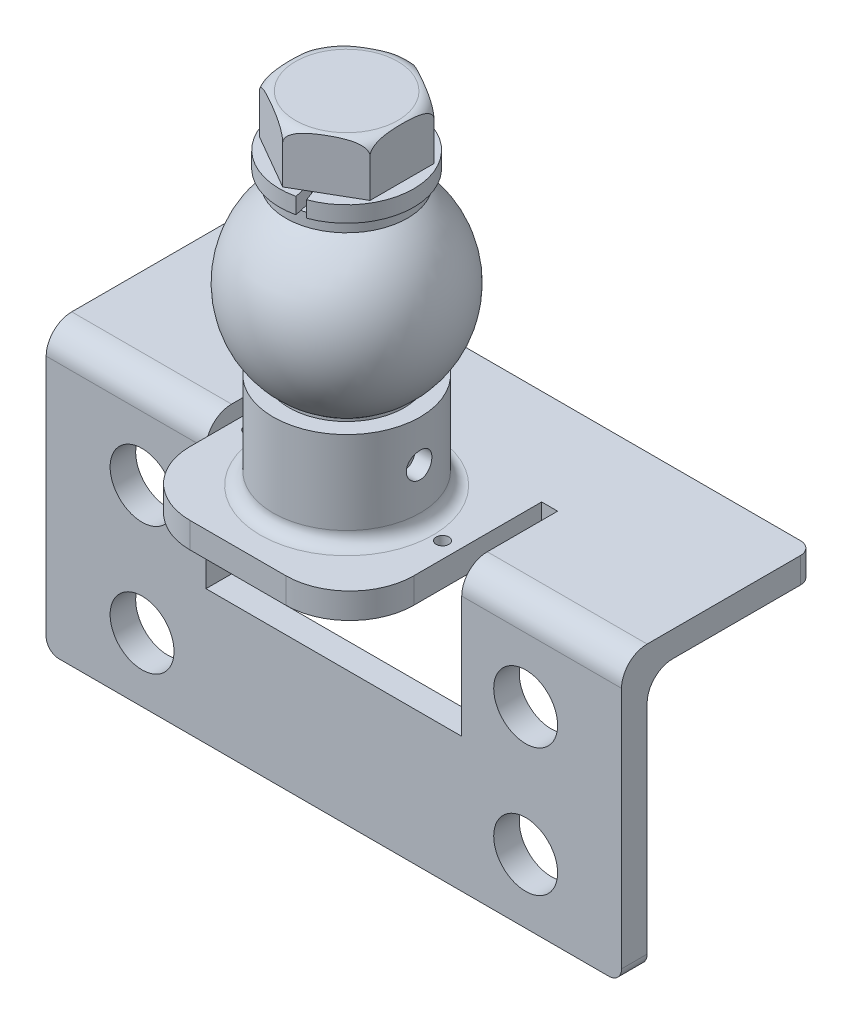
SolidWorks part; units mm, degrees
other "<Door Bracket_02>-<Cut-Extrude8>"
other "<Door Bracket_02>-<Cut-Extrude6>"
other "<Door Bracket_02>-<Boss-Extrude5>"
other "<Door Bracket_02>-<Boss-Extrude4>"
other "<Door Bracket_02>-<Cut-Extrude4>"
ref_plane "Front Plane" through (0, 0, 0) normal (0, 0, 1) x (1, 0, 0)
ref_plane "Top Plane" through (0, 0, 0) normal (0, 1, 0) x (1, 0, 0)
ref_plane "Right Plane" through (0, 0, 0) normal (1, 0, 0) x (0, 0, -1)
mirrored part "Door Bracket_02_Mirrored"
